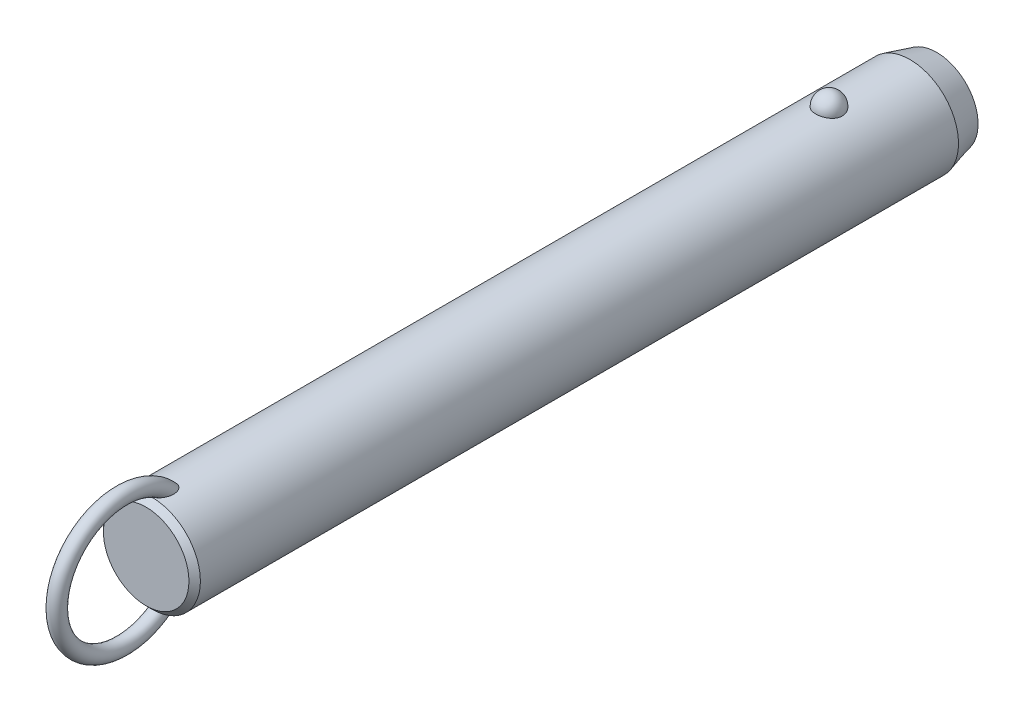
SolidWorks part; units mm, degrees
ref_plane "Front Plane" through (0, 0, 0) normal (0, 0, 1) x (1, 0, 0)
ref_plane "Top Plane" through (0, 0, 0) normal (0, 1, 0) x (1, 0, 0)
ref_plane "Right Plane" through (0, 0, 0) normal (1, 0, 0) x (0, 0, -1)
sketch "Sketch2" plane through (0, 0, 0) normal (0, 0, 1) x (1, 0, 0)
  circle A0 centre (0, 0) radius 12.7
  point P3 (0, 12.7)
  dimension "D1" = 25.4
extrude "Boss-Extrude1" add sketch "Sketch2" along normal blind 162.6
sketch "Sketch3" plane through (0, 0, 0) normal (0, 0, -1) x (-1, 0, 0)
  circle A0 centre (0, 0) radius 12.7
  dimension "D1" = 25.4
extrude "Boss-Extrude2" add sketch "Sketch3" along normal blind 31.7
chamfer "Chamfer1" distance 7 angle 15 1 edges at (-12.7, 0, -31.7)
sketch "Sketch12" plane through (0, 0, 0) normal (1, 0, 0) x (0, 0, -1)
  line L0 (-162.6, 12.7) -> (-162.6, -12.7) construction
  point P0 (-162.6, 0)
sketch "Sketch13" plane through (0, 0, 0) normal (1, 0, 0) x (0, 0, -1)
  circle A0 centre (-181.65, 0) radius 19.05
  point P2 (-162.6, 0)
  dimension "D1" = 38.1
sketch "Sketch14" plane through (0, 0, 0) normal (0, 1, 0) x (1, 0, 0)
  circle A0 centre (0, -164.6) radius 2
  point P2 (0, -162.6)
  dimension "D1" = 4
sweep "Sweep1" add profiles "Sketch14" path "Sketch13"
sketch "Sketch15" plane through (0, 0, 162.6) normal (0, 0, 1) x (1, 0, 0)
  circle A0 centre (0, 0) radius 12.7
  dimension "D1" = 25.4
extrude "Boss-Extrude3" add sketch "Sketch15" along normal blind 12.7
chamfer "Chamfer2" distance 1.5 angle 45 1 edges at (12.7, 0, 175.3)
sketch "Sketch18" plane through (0, 0, 0) normal (1, 0, 0) x (0, 0, -1)
  line L0 (24.7, 12.7) -> (-167.451, 12.7) construction
  line L1 (3.5, 16.2) -> (3.5, 9.2)
  line L2 (-167.451, -12.7) -> (24.7, -12.7) construction
  arc A0 (3.5, 16.2) -> (3.5, 9.2) centre (3.5, 12.7) ccw
  point P4 (0, 12.7)
  dimension "D1" = 28.9
revolve "Revolve1" add sketch "Sketch18" angle 360 about L1
